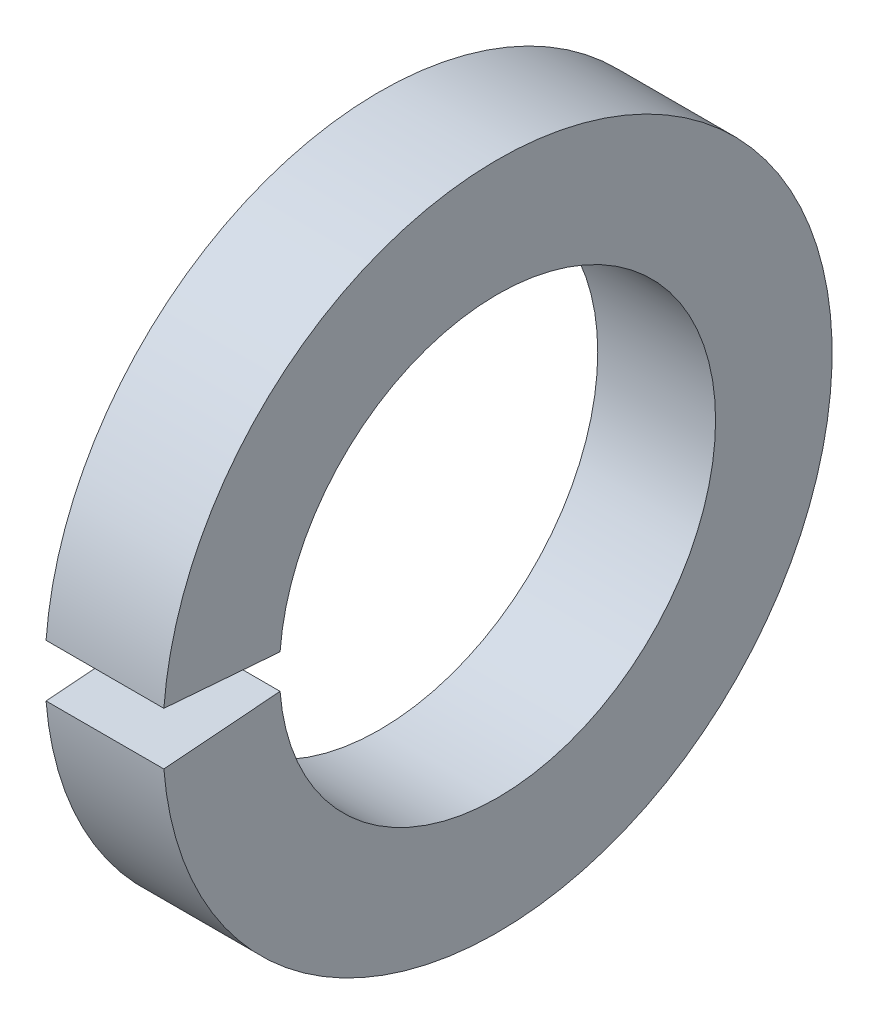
SolidWorks part; units mm, degrees
ref_plane "Plane1" through (0, 0, 0) normal (0, 0, 1) x (1, 0, 0)
ref_plane "Plane2" through (0, 0, 0) normal (0, 1, 0) x (1, 0, 0)
ref_plane "Plane3" through (0, 0, 0) normal (1, 0, 0) x (0, 0, -1)
sketch "Sketch1" plane through (0, 0, 0) normal (0, 0, 1) x (1, 0, 0)
  line L0 (-34.925, 0) -> (9.525, 0) construction
  line L1 (0, 2.2098) -> (0, 3.3909)
  line L2 (0, 3.3909) -> (-1.1938, 3.3909)
  line L3 (-1.1938, 3.3909) -> (-1.1938, 2.2098)
  line L4 (-1.1938, 2.2098) -> (0, 2.2098)
  dimension "Thickness" = 1.1938
  dimension "Inside_dia" = 4.4196
  dimension "Outside_dia" = 6.7818
revolve "Base-Revolve" add sketch "Sketch1" angle 360 about L0
sketch "Sketch2" plane through (0, 0, 0) normal (-1, 0, 0) x (0, -1, 0)
  line L0 (0, 0) -> (0.2714, 3.4481)
  line L1 (0, -3.175) -> (0, 12.7) construction
  line L2 (0, 0) -> (-0.2714, 3.4481)
  arc A0 (0.2714, 3.4481) -> (-0.2714, 3.4481) centre (0, 0) ccw
  dimension "D1" = 3.4587
  dimension "Gap_ang" = 9
extrude "Gap" cut sketch "Sketch2" along normal through all
equation "\"D1@Sketch2\" = \"Outside_dia@Sketch1\" * 0.51"
